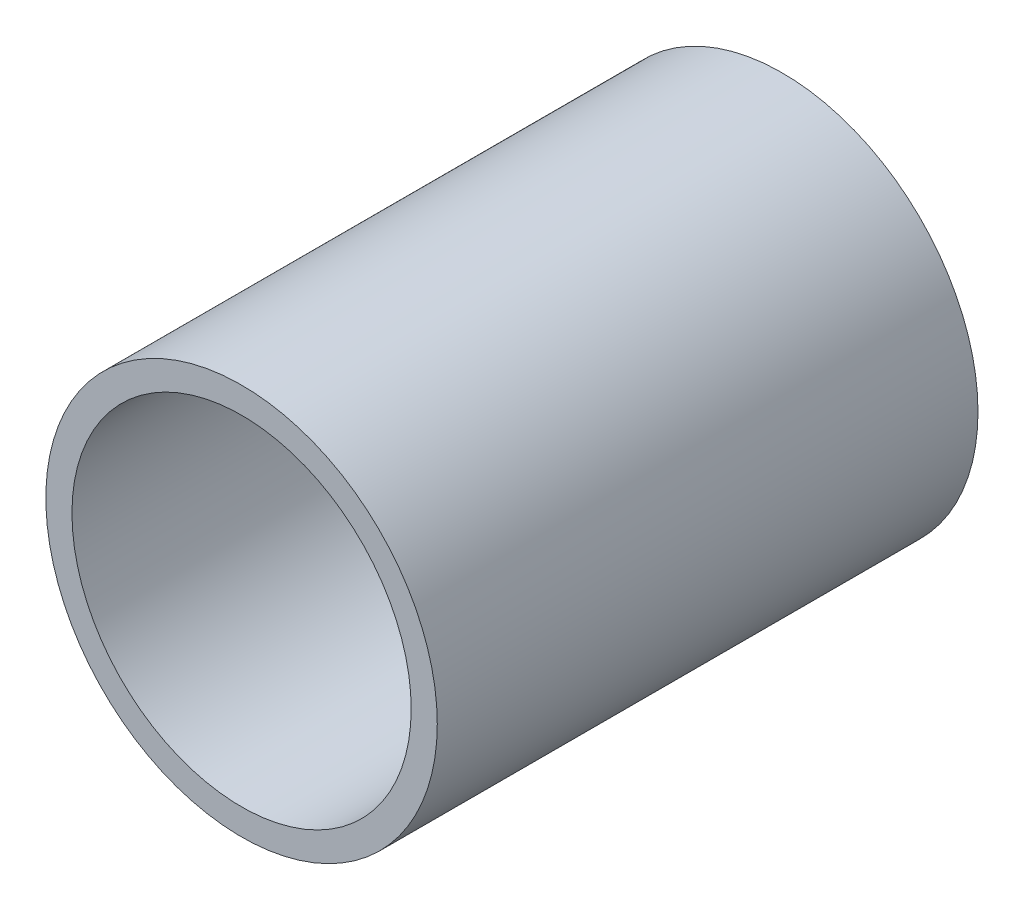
SolidWorks part; units mm, degrees
ref_plane "Plane1" through (0, 0, 0) normal (0, 0, 1) x (1, 0, 0)
ref_plane "Plane2" through (0, 0, 0) normal (0, 1, 0) x (1, 0, 0)
ref_plane "Plane3" through (0, 0, 0) normal (1, 0, 0) x (0, 0, -1)
sketch "Sketch1" plane through (0, 0, 0) normal (0, 0, 1) x (1, 0, 0)
  circle A0 centre (0, 0) radius 82.55
  circle A1 centre (0, 0) radius 95.25
  dimension "D1" = 165.1
  dimension "D2" = 190.5
extrude "Base-Extrude" add sketch "Sketch1" along normal blind 263.144
